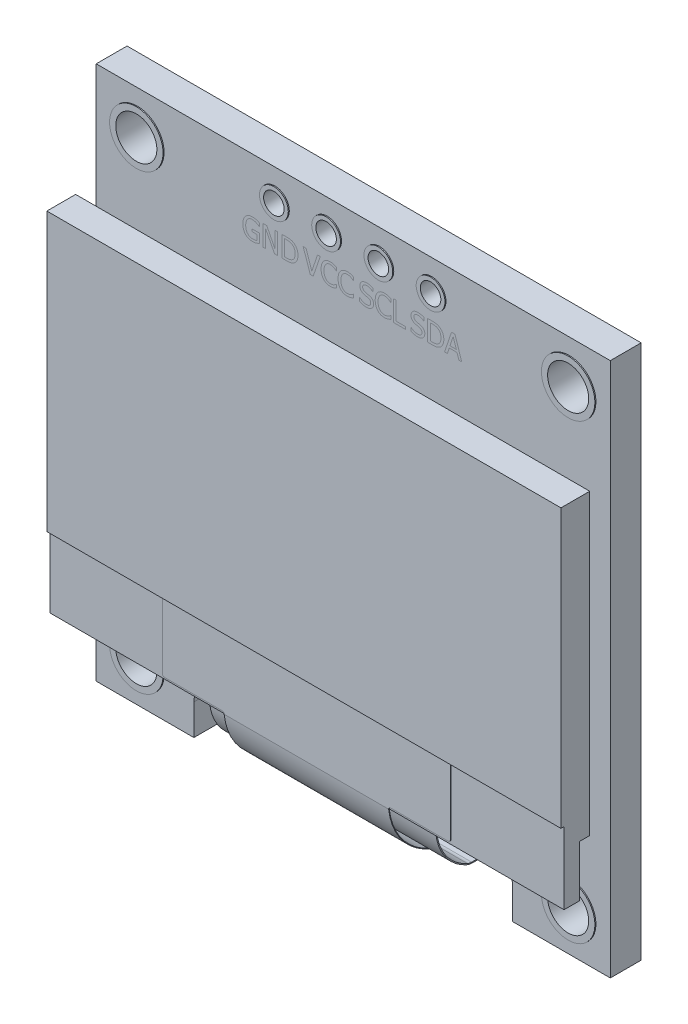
SolidWorks part; units mm, degrees
ref_plane "前视基准面" through (0, 0, 0) normal (0, 0, 1) x (1, 0, 0)
ref_plane "上视基准面" through (0, 0, 0) normal (0, 1, 0) x (1, 0, 0)
ref_plane "右视基准面" through (0, 0, 0) normal (1, 0, 0) x (0, 0, -1)
imported_body "输入1"
move or copy body "实体-移动/复制1" bodies to move or copy 101 copy no rotation origin (0, 1.35, 0) rotation axis (1, 0, 0) rotation angle 90
